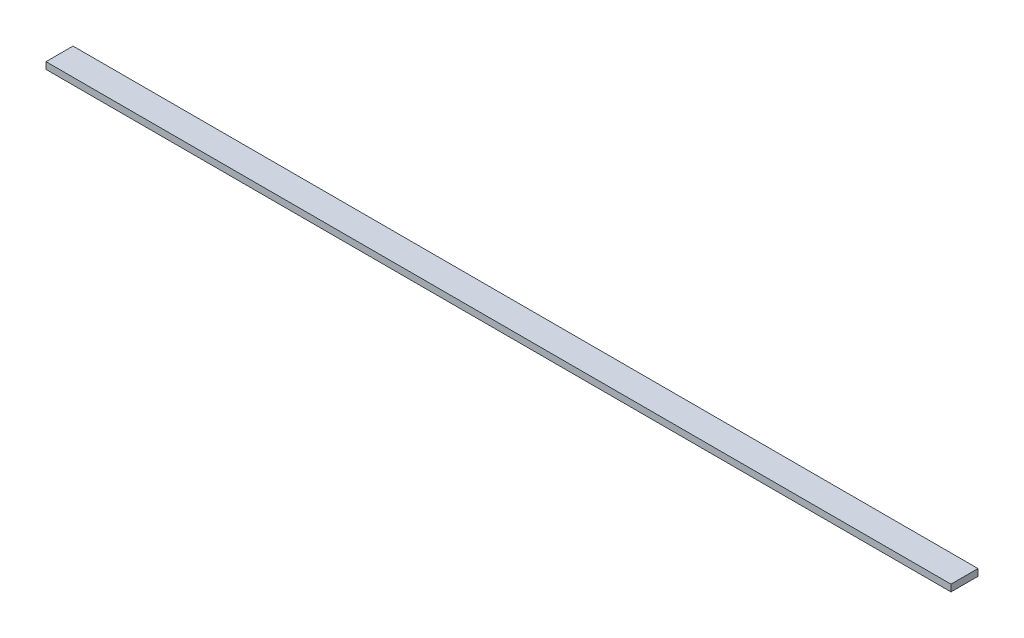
SolidWorks part; units mm, degrees
ref_plane "Front Plane" through (0, 0, 0) normal (0, 0, 1) x (1, 0, 0)
ref_plane "Top Plane" through (0, 0, 0) normal (0, 1, 0) x (1, 0, 0)
ref_plane "Right Plane" through (0, 0, 0) normal (1, 0, 0) x (0, 0, -1)
sketch "Sketch1" plane through (0, 0, 0) normal (0, 1, 0) x (1, 0, 0)
  line L1 (-425.45, -12.7) -> (425.45, -12.7)
  line L2 (-425.45, -12.7) -> (-425.45, 12.7)
  line L3 (-425.45, 12.7) -> (425.45, 12.7)
  line L4 (425.45, -12.7) -> (425.45, 12.7)
  line L5 (-425.45, -12.7) -> (425.45, 12.7) construction
  line L6 (-425.45, 12.7) -> (425.45, -12.7) construction
  point P0 (0, 0)
extrude "Boss-Extrude1" add sketch "Sketch1" along normal blind 6.35
equation "\"horizontal-component-length\"= \"railing-width\" - \"railing padding\""
equation "\"horizontal-component-width\"= 1in"
equation "\"D1@Sketch1\"=\"horizontal-component-length\""
equation "\"D2@Sketch1\"=\"horizontal-component-width\""
equation "\"material-thickness\"= .25in"
equation "\"D1@Boss-Extrude1\"=\"material-thickness\""
equation "\"railing-width\"= 34in"
equation "\"railing padding\"= .5in"
